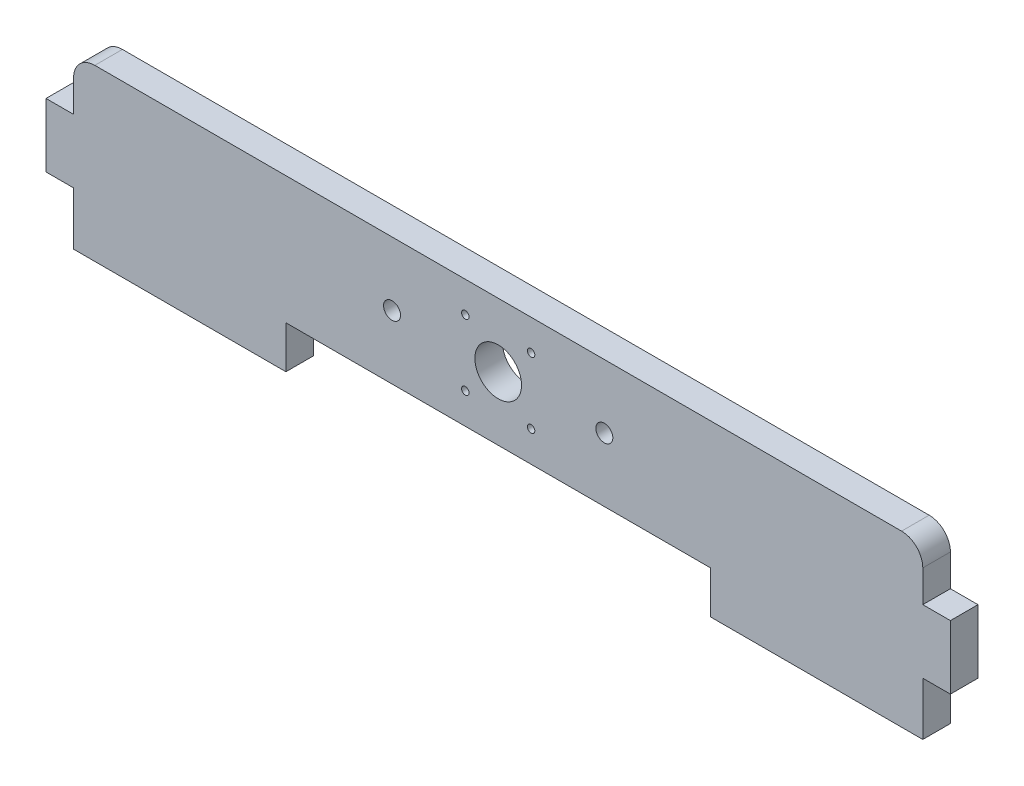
SolidWorks part; units mm, degrees
ref_plane "Alzado" through (0, 0, 0) normal (0, 0, 1) x (1, 0, 0)
ref_plane "Planta" through (0, 0, 0) normal (0, 1, 0) x (1, 0, 0)
ref_plane "Vista lateral" through (0, 0, 0) normal (1, 0, 0) x (0, 0, -1)
sketch "Croquis1" plane through (0, 0, 0) normal (0, 0, 1) x (1, 0, 0)
  line L0 (100, -40) -> (200, -40)
  line L1 (-200, -40) -> (-100, -40)
  line L2 (-200, -40) -> (-200, -15)
  line L3 (-200, 40) -> (200, 40)
  line L4 (200, -40) -> (200, -15)
  line L5 (200, 15) -> (200, 40)
  line L6 (200, 15) -> (213, 15)
  line L7 (-100, -20) -> (100, -20)
  line L8 (-100, -20) -> (-100, -40)
  line L10 (100, -20) -> (100, -40)
  line L12 (200, -15) -> (213, -15)
  line L13 (213, 15) -> (213, -15)
  line L14 (0, 0) -> (0, 63.4179) construction
  line L15 (-200, -15) -> (-213, -15)
  line L16 (-213, 15) -> (-213, -15)
  line L17 (-200, 15) -> (-213, 15)
  line L18 (-200, 15) -> (-200, 40)
  point P0 (0, 0)
  dimension "D1" = 400
  dimension "D2" = 80
  dimension "D3" = 100
  dimension "D4" = 100
  dimension "D5" = 60
  dimension "D6" = 13
  dimension "D7" = 25
  dimension "D8" = 25
extrude "Saliente-Extruir1" add sketch "Croquis1" along normal blind 13
sketch "Croquis2" plane through (0, 0, 0) normal (0, 0, -1) x (-1, 0, 0)
  line L0 (0, -20) -> (0, 10) construction
  line L1 (0, 21) -> (0, -20) construction
  line L2 (-200, 40) -> (200, 40) construction
  line L3 (0, 10) -> (54, 10) construction
  line L4 (-50, 10) -> (0, 10) construction
  line L16 (-46, 10) -> (-54, 10) construction
  line L20 (46, 10) -> (54, 10) construction
  line L23 (0, 21) -> (0, 40) construction
  circle A0 centre (0, 10) radius 11
  circle A1 centre (50, 10) radius 4
  circle A2 centre (-50, 10) radius 4
  circle A3 centre (15.5, 25.5) radius 1.75
  circle A4 centre (15.5, -5.5) radius 1.75
  circle A5 centre (-15.5, 25.5) radius 1.75
  circle A6 centre (-15.5, -5.5) radius 1.75
  dimension "D1" = 8
  dimension "D2" = 8
  dimension "D3" = 22
  dimension "D6" = 3.5
  dimension "D7" = 3.5
  dimension "D8" = 3.5
  dimension "D9" = 3.5
  dimension "D4" = 31
  dimension "D5" = 31
  dimension "D10" = 50
  dimension "D11" = 50
extrude "Cortar-Extruir1" cut sketch "Croquis2" against normal blind 13
fillet "Redondeo1" radius 10 1 edges at (-200, 40, 6.5)
fillet "Redondeo2" radius 10 1 edges at (200, 40, 6.5)
